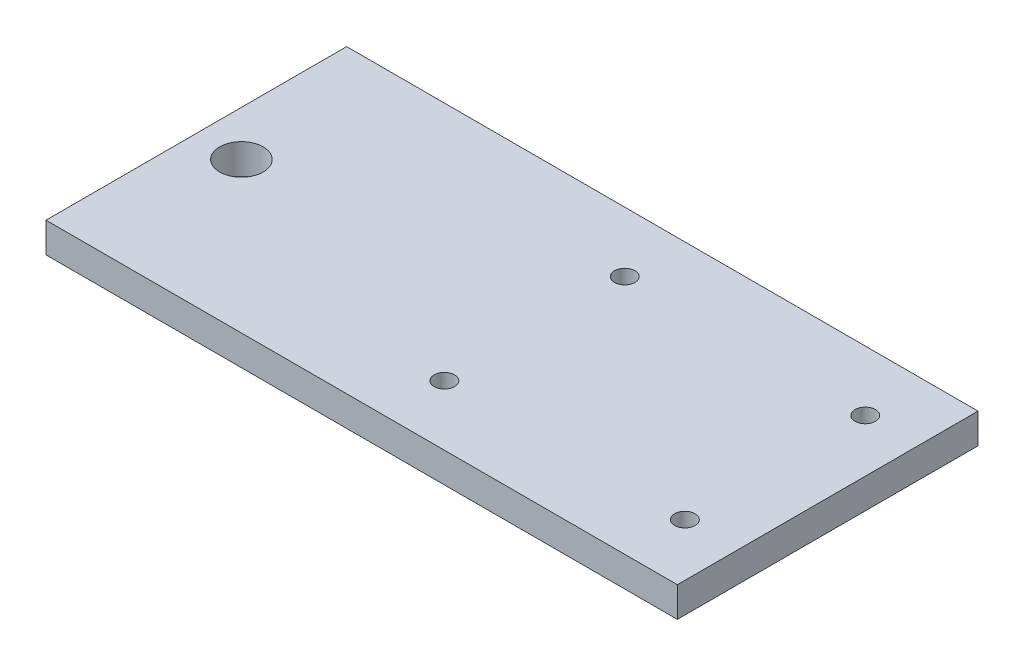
SolidWorks part; units mm, degrees
ref_plane "Plan de face" through (0, 0, 0) normal (0, 0, 1) x (1, 0, 0)
ref_plane "Plan de dessus" through (0, 0, 0) normal (0, 1, 0) x (1, 0, 0)
ref_plane "Plan de droite" through (0, 0, 0) normal (1, 0, 0) x (0, 0, -1)
sketch "Esquisse1" plane through (0, 0, 0) normal (1, 0, 0) x (0, 0, -1)
  line L1 (-50, 0) -> (50, 0)
  line L2 (-50, 0) -> (-50, -10)
  line L3 (-50, -10) -> (50, -10)
  line L4 (50, 0) -> (50, -10)
  dimension "D1" = 100
  dimension "D2" = 10
extrude "Extrusion1" add sketch "Esquisse1" along normal mid plane 210
sketch "Esquisse2" plane through (0, 0, 0) normal (0, 1, 0) x (-1, 0, 0)
  line L0 (-105, 50) -> (105, 50) construction
  line L1 (-105, -50) -> (-105, 50) construction
  circle A0 centre (90, 0) radius 7.25
  dimension "D1" = 14.5
  dimension "D2" = 50
  dimension "D3" = 195
extrude "Enlèv. mat.-Extru.1" cut sketch "Esquisse2" against normal blind 210
hole_wizard "Trou taraudé M8x1.251" positions "Esquisse4" profile "Esquisse3" tap size "M8x1.25" standard "DIN"
sketch "Esquisse4" plane through (0, 0, 0) normal (0, 1, 0) x (-1, 0, 0)
  line L0 (-105, -50) -> (-105, 50) construction
  line L1 (-105, -50) -> (105, -50) construction
  point P0 (-7.5, 30)
  point P1 (-7.5, -30)
  point P2 (-87.5, -30)
  point P3 (-87.5, 30)
  dimension "D1" = 17.5
  dimension "D2" = 80
  dimension "D3" = 20
  dimension "D4" = 60
sketch "Esquisse3" plane through (7.5, 0, 30) normal (1, 0, 0) x (0, 0, 1)
  line L0 (0, 0) -> (0, 10)
  line L1 (0, 10) -> (3.4, 10)
  line L2 (3.4, 10) -> (3.4, 0)
  line L5 (3.4, 0) -> (0, 0)
  line L11 (0, -6.35) -> (0, 107.95) construction
  dimension "Diamètre du trou pour taraudage jusqu'au prochain" = 6.8
  dimension "Profondeur du trou pour taraudage jusqu'au prochain" = 10
